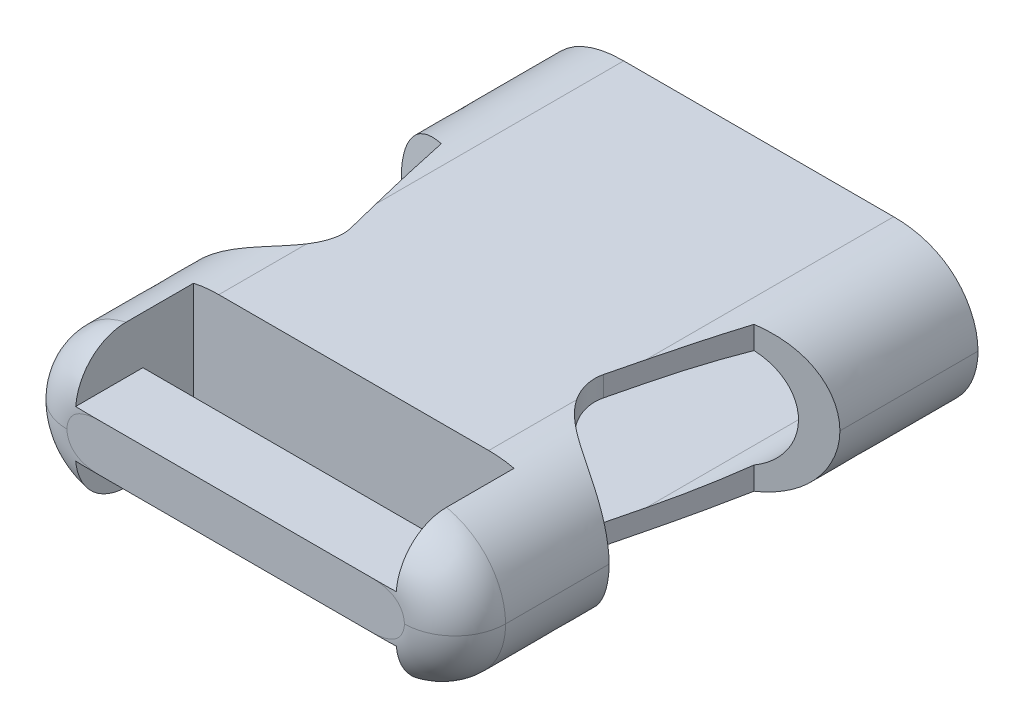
SolidWorks part; units mm, degrees
ref_plane "Piano frontale" through (0, 0, 0) normal (0, 0, 1) x (1, 0, 0)
ref_plane "Piano superiore" through (0, 0, 0) normal (0, 1, 0) x (1, 0, 0)
ref_plane "Piano destro" through (0, 0, 0) normal (1, 0, 0) x (0, 0, -1)
sketch "Schizzo1" plane through (0, 0, 0) normal (0, 0, 1) x (1, 0, 0)
  line L0 (-8, 0) -> (8, 0) construction
  line L1 (-8, 4.4) -> (8, 4.4)
  line L2 (-8, -4.4) -> (8, -4.4)
  line L3 (0, 15.06) -> (0, -12.592) construction
  line L4 (-13, 15.06) -> (-13, -16.3947) construction
  line L5 (-22.0805, 0) -> (21.6781, 0) construction
  spline S0 degree 3 poles (-13, 0) (-13.0039, 1.9698) (-11.5386, 4.4) (-8, 4.4) knots 0 0 0 0 1 1 1 1
  spline S1 degree 3 poles (-13, 0) (-13.0039, -1.9698) (-11.5386, -4.4) (-8, -4.4) knots 0 0 0 0 1 1 1 1
  spline S2 degree 3 poles (13, 0) (13.0039, -1.9698) (11.5386, -4.4) (8, -4.4) knots 0 0 0 0 1 1 1 1
  spline S3 degree 3 poles (13, 0) (13.0039, 1.9698) (11.5386, 4.4) (8, 4.4) knots 0 0 0 0 1 1 1 1
  point P3 (0, 0)
  dimension "D2" = 16
  dimension "D3" = 13
extrude "Estrusione-Estrusione1" add sketch "Schizzo1" along normal blind 31
sketch "Schizzo5" plane through (0, 4.4, 0) normal (0, 1, 0) x (1, 0, 0)
  line L2 (-13.5066, -8) -> (-13.5066, -32.3189) construction
  line L6 (0, 0) -> (0, -31) construction
  line L7 (8, -31) -> (-8, -31) construction
  line L8 (8, 0) -> (-8, 0) construction
  line L9 (-13.5066, -8) -> (-9.2703, -9.5419)
  line L10 (-9.2703, -9.5419) -> (-7.5, -16.7006)
  line L11 (-13.5066, -8) -> (-16.0803, -8)
  line L12 (-16.0803, -8) -> (-16.0803, -22)
  line L13 (-16.0803, -22) -> (-13.5066, -22)
  line L14 (16.0803, -22) -> (13.5066, -22)
  line L15 (16.0803, -8) -> (16.0803, -22)
  line L16 (13.5066, -8) -> (16.0803, -8)
  line L17 (9.2703, -9.5419) -> (7.5, -16.7006)
  line L18 (13.5066, -8) -> (9.2703, -9.5419)
  spline S0 degree 3 poles (-7.5, -16.7006) (-7.1188, -18.2421) (-8.7151, -20.8157) (-13.5066, -22) knots 0 0 0 0 1 1 1 1
  spline S1 degree 3 poles (7.5, -16.7006) (7.1188, -18.2421) (8.7151, -20.8157) (13.5066, -22) knots 0 0 0 0 1 1 1 1
  dimension "D1" = 7.5
  dimension "D2" = 8
  dimension "D3" = 14
extrude "Taglio-Estrusione1" cut sketch "Schizzo5" against normal blind 10
sketch "Schizzo6" plane through (0, 4.4, 0) normal (0, 1, 0) x (1, 0, 0)
  line L0 (0, 0) -> (0, -31) construction
  line L1 (8, -31) -> (-8, -31) construction
  line L3 (-9.5, -24) -> (9.5, -24)
  line L4 (-9.5, -24) -> (-9.5, -27)
  line L5 (-9.5, -27) -> (9.5, -27)
  line L6 (9.5, -24) -> (9.5, -27)
  line L7 (-9.5, -24) -> (9.5, -27) construction
  line L8 (-9.5, -27) -> (9.5, -24) construction
  point P5 (0, -25.5)
  dimension "D1" = 19
  dimension "D2" = 3
  dimension "D3" = 4
extrude "Taglio-Estrusione2" cut sketch "Schizzo6" against normal blind 10 contours L5 L3 M13 M15 | L6 L3 L5 M15 | L4 L5 L3 M13
fillet "Raccordo1" radius 3 6 edges at (0, 4.4, 31) (0, -4.4, 31)
sketch "Schizzo7" plane through (0, 0, 0) normal (0, 0, 1) x (1, 0, 0)
  line L0 (0, 10.5563) -> (0, -10.4763) construction
  line L1 (-16.2161, 0) -> (21.9528, 0) construction
  line L2 (-9.5, -1.4) -> (9.5, -1.4)
  line L3 (-9.5, 8.3917) -> (9.5, 8.3917)
  line L4 (-9.5, 8.3917) -> (-9.5, 1.4)
  line L5 (-9.5, 1.4) -> (9.5, 1.4)
  line L6 (9.5, 8.3917) -> (9.5, 1.4)
  line L7 (9.5, -8.3917) -> (9.5, -1.4)
  line L8 (-9.5, -8.3917) -> (9.5, -8.3917)
  line L9 (-9.5, -8.3917) -> (-9.5, -1.4)
  point P9 (0, 8.3917)
  dimension "D1" = 19
  dimension "D2" = 1.4
extrude "Taglio-Estrusione3" cut sketch "Schizzo7" along normal blind 10 from offset 26
sketch "Schizzo9" plane through (0, 0, 0) normal (0, 0, -1) x (-1, 0, 0)
  line L0 (0, 8.0869) -> (0, -9.0679) construction
  line L1 (-14.7778, 0) -> (15.306, 0) construction
  line L2 (8, 0) -> (-8, 0) construction
  line L3 (8, -3.2) -> (-8, -3.2)
  line L4 (8, 3.2) -> (-8, 3.2)
  arc A0 (8, -3.2) -> (8, 3.2) centre (8, 0) ccw
  arc A1 (-8, 3.2) -> (-8, -3.2) centre (-8, 0) ccw
  point P7 (0, 0)
  dimension "D2" = 3.2
  dimension "D1" = 16
extrude "Taglio-Estrusione4" cut sketch "Schizzo9" against normal blind 19.5
sketch "Schizzo10" plane through (0, 0, 0) normal (0, 0, -1) x (-1, 0, 0)
  line L0 (0, 6.6441) -> (0, -9.5699) construction
  line L2 (-4.1, 1.2) -> (-2.6, 1.2)
  line L3 (-4.1, 1.2) -> (-4.1, 3.2)
  line L4 (-4.1, 3.2) -> (-2.6, 3.2)
  line L5 (-2.6, 1.2) -> (-2.6, 3.2)
  line L6 (2.6, 1.2) -> (2.6, 3.2)
  line L7 (4.1, 3.2) -> (2.6, 3.2)
  line L8 (4.1, 1.2) -> (4.1, 3.2)
  line L9 (4.1, 1.2) -> (2.6, 1.2)
  line L10 (8, 3.2) -> (-8, 3.2) construction
  point P13 (-2.6, -3.2)
  point P14 (0, 0)
  point P15 (-2.6, -3.2)
  dimension "D1" = 1.5
  dimension "D2" = 2
  dimension "D3" = 2.6
extrude "Estrusione-Estrusione2" add sketch "Schizzo10" against normal up to surface (19.5 mm away)
